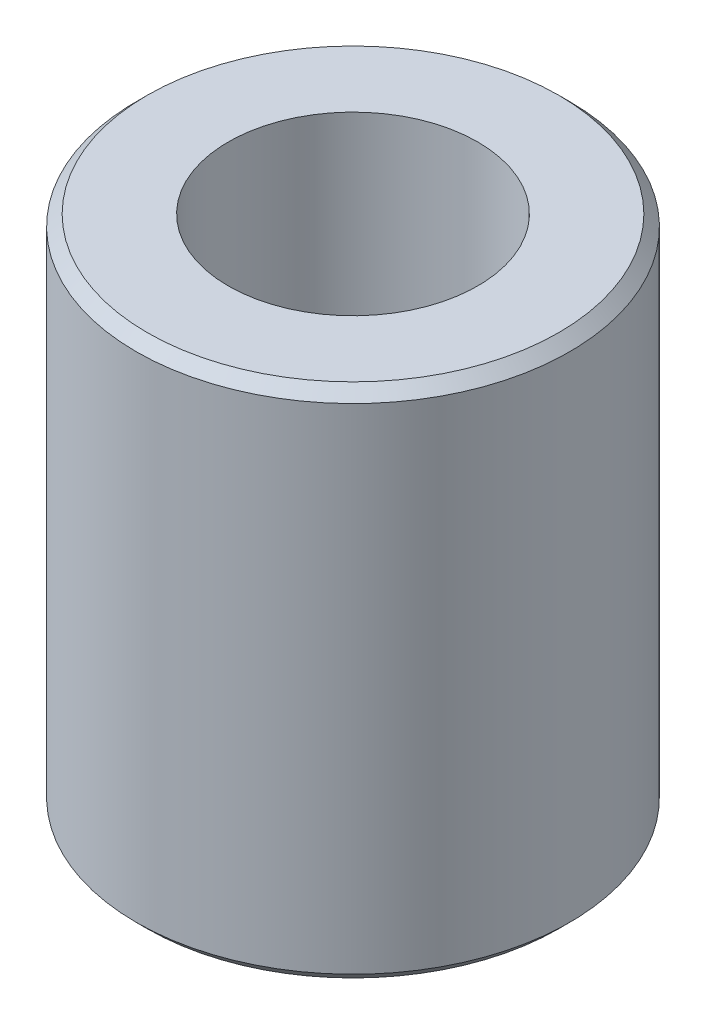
SolidWorks part; units mm, degrees
ref_plane "Front Plane" through (0, 0, 0) normal (0, 0, 1) x (1, 0, 0)
ref_plane "Top Plane" through (0, 0, 0) normal (0, 1, 0) x (1, 0, 0)
ref_plane "Right Plane" through (0, 0, 0) normal (1, 0, 0) x (0, 0, -1)
sketch "Sketch1" plane through (0, 0, 0) normal (0, 0, 1) x (1, 0, 0)
  line L0 (0, 12.4902) -> (0, -31.8413) construction
  line L1 (0, 0) -> (-9.9949, 0)
  line L2 (0, 0) -> (0, -23.8125)
  line L3 (0, -23.8125) -> (-9.9949, -23.8125)
  line L4 (-9.9949, 0) -> (-9.9949, -23.8125)
  dimension "D1" = 19.9898
  dimension "D2" = 23.8125
revolve "Revolve1" add sketch "Sketch1" angle 360 about L0
hole_wizard "1/2-20 Tapped Hole1" positions "Sketch3" profile "Sketch2" tap size "1/2-20" standard "ANSI Inch"
sketch "Sketch3" plane through (0, 0, 0) normal (0, 1, 0) x (1, 0, 0)
  point P0 (0, 0)
sketch "Sketch2" plane through (0, 0, 0) normal (1, 0, 0) x (0, 0, 1)
  line L0 (0, 0) -> (0, 23.8125)
  line L1 (0, 23.8125) -> (5.7544, 23.8125)
  line L2 (5.7544, 23.8125) -> (5.7544, 0)
  line L5 (5.7544, 0) -> (0, 0)
  line L11 (0, -6.35) -> (0, 107.95) construction
  dimension "Thru Tap Drill Dia." = 11.5087
  dimension "Thru Tap Drill Depth" = 23.8125
sketch "Sketch4" plane through (0, 0, 0) normal (0, 0, 1) x (1, 0, 0)
  line L0 (-7.1437, -23.8125) -> (-7.1437, -11.1125)
  line L1 (-9.9949, -23.8125) -> (9.9949, -23.8125) construction
  line L2 (-7.1437, -11.1125) -> (0, -6.8201)
  line L3 (0, -6.8201) -> (0, -23.8125)
  line L4 (0, -23.8125) -> (-7.1437, -23.8125)
  line L5 (0, 4.8636) -> (0, -30.7737) construction
  dimension "D1" = 14.2875
  dimension "D2" = 12.7
  dimension "D3" = 59
revolve "Cut-Revolve1" cut sketch "Sketch4" angle 360 about L5
chamfer "Chamfer1" distance 1.016 angle 45 1 edges at (0, -23.8125, 7.1437)
sketch "Sketch5" plane through (0, -23.8125, 0) normal (0, -1, 0) x (1, 0, 0)
  line L1 (8.2489, 0) -> (4.1244, 7.1437)
  line L2 (4.1244, 7.1437) -> (-4.1244, 7.1437)
  line L3 (-4.1244, 7.1437) -> (-8.2489, 0)
  line L4 (-8.2489, 0) -> (-4.1244, -7.1437)
  line L5 (-4.1244, -7.1437) -> (4.1244, -7.1437)
  line L6 (4.1244, -7.1437) -> (8.2489, 0)
  circle A0 centre (0, 0) radius 7.1437 construction
  circle A2 centre (0, 0) radius 7.1437 construction
extrude "Cut-Extrude1" cut sketch "Sketch5" against normal blind 11.1252
chamfer "Chamfer2" distance 0.508 angle 45 2 edges at (0, -23.8125, 9.9949) (0, 0, 9.9949)
